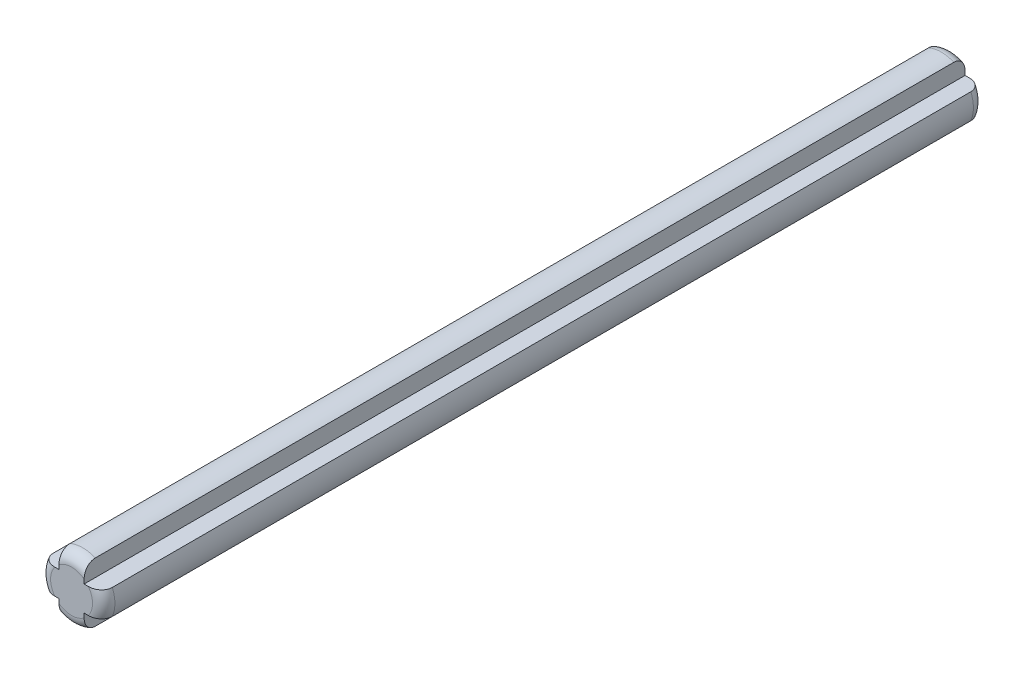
SolidWorks part; units mm, degrees
ref_plane "Front Plane" through (0, 0, 0) normal (0, 0, 1) x (1, 0, 0)
ref_plane "Top Plane" through (0, 0, 0) normal (0, 1, 0) x (1, 0, 0)
ref_plane "Right Plane" through (0, 0, 0) normal (1, 0, 0) x (0, 0, -1)
sketch "Sketch1" plane through (0, 0, 0) normal (0, 0, 1) x (1, 0, 0)
  line L0 (-0.9, 2.1166) -> (-0.9, 0.9)
  line L1 (-0.9, 0.9) -> (-2.1166, 0.9)
  line L2 (0, 3.8484) -> (0, -4.1163) construction
  line L3 (-3.3115, 0) -> (4.7978, 0) construction
  line L4 (-0.9, -2.1166) -> (-0.9, -0.9)
  line L5 (-0.9, -0.9) -> (-2.1166, -0.9)
  line L6 (0.9, -2.1166) -> (0.9, -0.9)
  line L7 (0.9, -0.9) -> (2.1166, -0.9)
  line L8 (0.9, 2.1166) -> (0.9, 0.9)
  line L9 (0.9, 0.9) -> (2.1166, 0.9)
  circle A0 centre (0, 0) radius 2.3
  dimension "D1" = 4.6
  dimension "D2" = 0.9
  dimension "D3" = 0.9
extrude "Boss-Extrude1" add sketch "Sketch1" against normal blind 63 contours L8 A0 L0 L1 L5 L4 L6 L7 L9
fillet "Fillet1" radius 0.8 8 edges at (2.3, 0, -63) (0, 2.3, -63) (-2.3, 0, -63) (2.3, 0, 0) (0, -2.3, -63) (0, -2.3, 0) (-2.3, 0, 0) (0, 2.3, 0)
